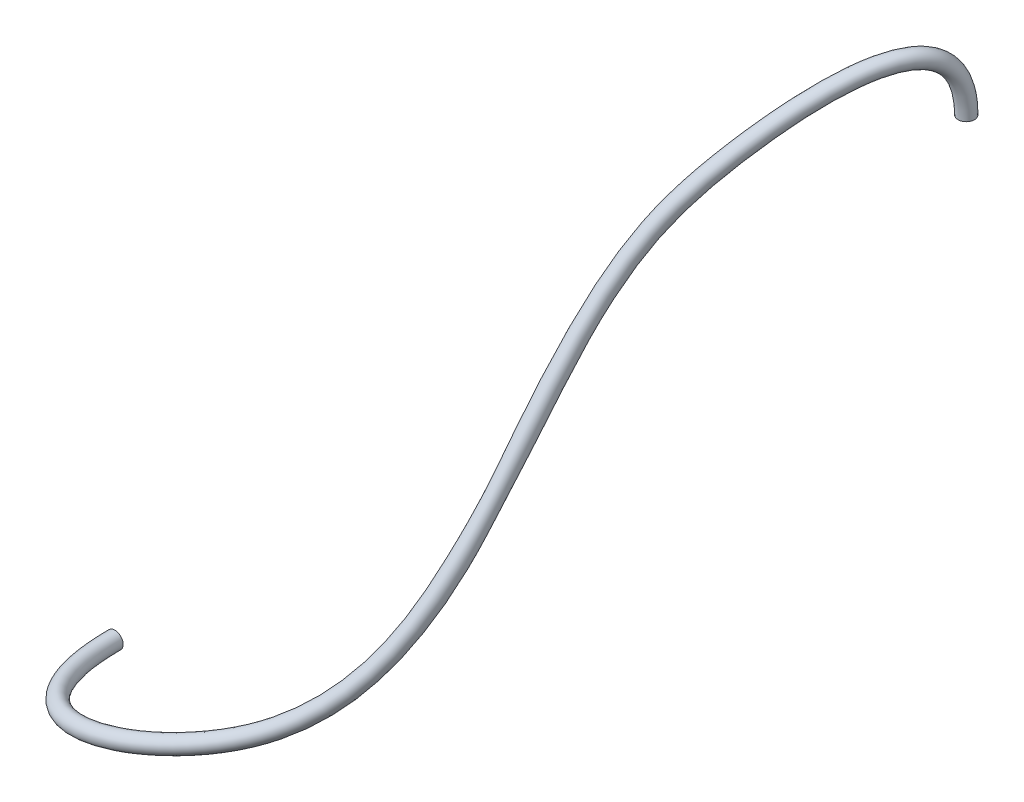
SolidWorks part; units mm, degrees
ref_plane "Płaszczyzna przednia" through (0, 0, 0) normal (0, 0, 1) x (1, 0, 0)
ref_plane "Płaszczyzna górna" through (0, 0, 0) normal (0, 1, 0) x (1, 0, 0)
ref_plane "Płaszczyzna prawa" through (0, 0, 0) normal (1, 0, 0) x (0, 0, -1)
sketch3d "Szkic 3D1"
  line L17 (0, 0, 0) -> (0, 0, 351.812) construction
  line L21 (0, 0, 351.812) -> (286.463, 24.5239, -31.1698) construction
  line L22 (286.463, 24.5239, -31.1698) -> (420, 728.1521, -351) construction
  line L24 (420, 728.1521, -351) -> (420, 446, -351) construction
  circle A5 centre (420, 446, -351) radius 5 construction
  spline_without_curve S1
  point P65 (420, 441, -351)
  dimension "D1" = 1000
sketch "Szkic2" plane through (0, 0, 0) normal (0, 0, 1) x (1, 0, 0)
  circle A0 centre (0, 0) radius 7.5
  dimension "D1" = 15
sweep "Wyciągnięcie po ścieżce1" add profiles "Szkic2" path "Szkic 3D1"
